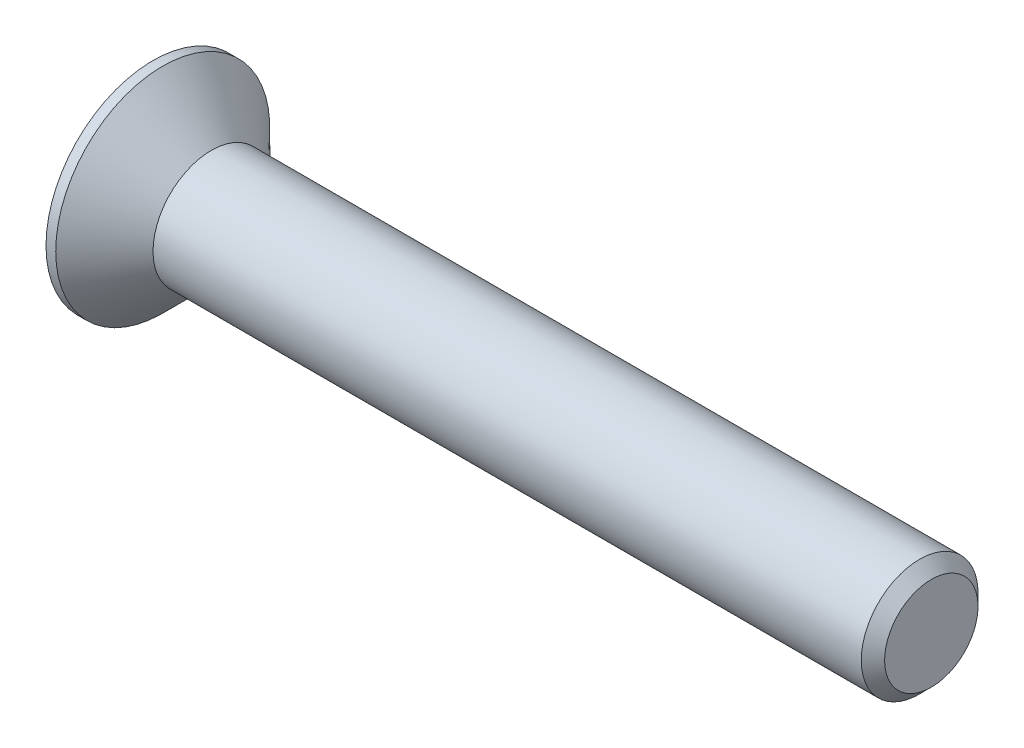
SolidWorks part; units mm, degrees
ref_plane "Front Plane" through (0, 0, 0) normal (0, 0, 1) x (1, 0, 0)
ref_plane "Top Plane" through (0, 0, 0) normal (0, 1, 0) x (1, 0, 0)
ref_plane "Right Plane" through (0, 0, 0) normal (1, 0, 0) x (0, 0, -1)
sketch "Sketch1" plane through (0, 0, 0) normal (0, 0, 1) x (1, 0, 0)
  line L1 (-3, 5.5) -> (-3, 0)
  line L2 (-3, 0) -> (37, 0)
  line L3 (37, 0) -> (37, 3)
  line L4 (37, 3) -> (0, 3)
  line L5 (-3, 5.5) -> (-2.5, 5.5)
  line L6 (-2.5, 5.5) -> (0, 3)
  dimension "D1" = 3
  dimension "D2" = 45
  dimension "D3" = 3
  dimension "D4" = 40
  dimension "D5" = 5.5
revolve "Revolve1" add sketch "Sketch1" angle 360 about L2
chamfer "Chamfer1" distance 0.6 angle 45 1 edges at (37, 0, 3)
sketch "Sketch2" plane through (-3, 0, 0) normal (-1, 0, 0) x (0, 0, 1)
  line L0 (-0.825, 3.3) -> (0.825, 3.3)
  line L1 (0.825, 3.3) -> (0.825, 0.825)
  line L2 (0.825, 0.825) -> (3.3, 0.825)
  line L3 (3.3, 0.825) -> (3.3, -0.825)
  line L4 (3.3, -0.825) -> (0.825, -0.825)
  line L5 (0.825, -0.825) -> (0.825, -3.3)
  line L6 (0.825, -3.3) -> (-0.825, -3.3)
  line L7 (-0.825, -3.3) -> (-0.825, -0.825)
  line L8 (-0.825, -0.825) -> (-3.3, -0.825)
  line L9 (-3.3, -0.825) -> (-3.3, 0.825)
  line L10 (-3.3, 0.825) -> (-0.825, 0.825)
  line L11 (-0.825, 0.825) -> (-0.825, 3.3)
  point P2 (0, 3.3)
  point P14 (0, -3.3)
  point P15 (3.3, 0)
  point P16 (-3.3, 0)
  dimension "D1" = 6.6
  dimension "D2" = 1.65
extrude "Cut-Extrude1" cut sketch "Sketch2" against normal blind 2.5
